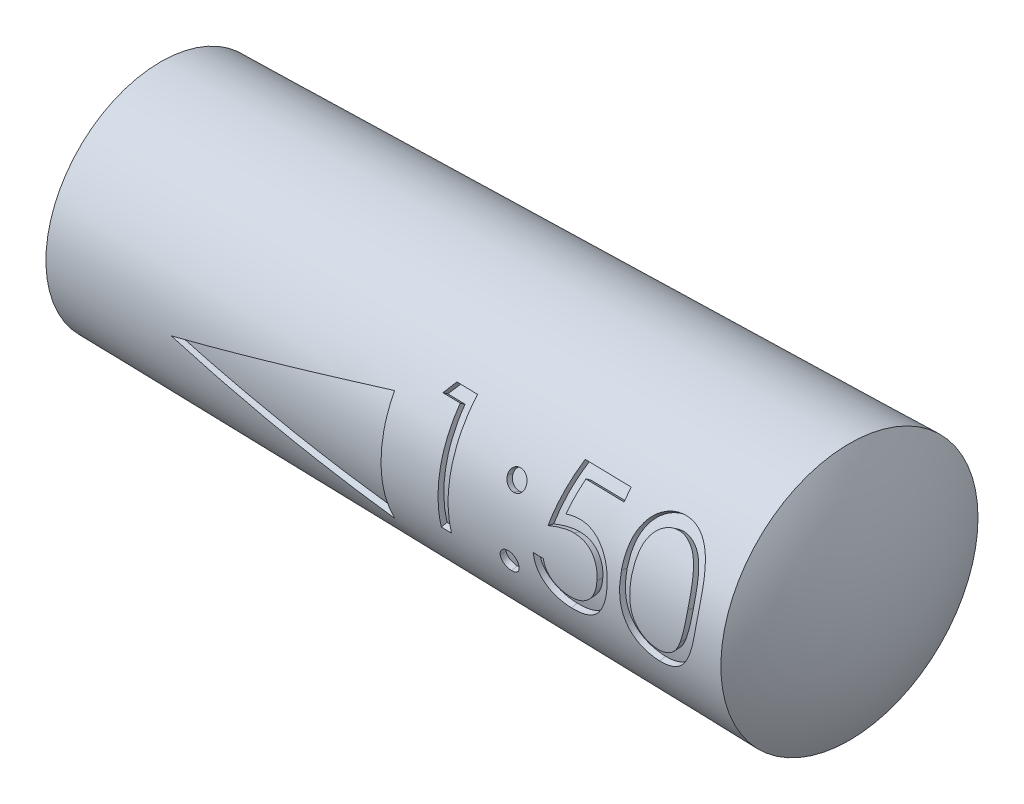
SolidWorks part; units mm, degrees
ref_plane "Front Plane" through (0, 0, 0) normal (0, 0, 1) x (1, 0, 0)
ref_plane "Top Plane" through (0, 0, 0) normal (0, 1, 0) x (1, 0, 0)
ref_plane "Right Plane" through (0, 0, 0) normal (1, 0, 0) x (0, 0, -1)
sketch "Sketch1" plane through (0, 0, 0) normal (1, 0, 0) x (0, 0, -1)
  circle A0 centre (0, 0) radius 1
  dimension "D1" = 2
extrude "Extrude1" add sketch "Sketch1" along normal mid plane 6
draft "Draft1" type of draft neutral plane draft angle 1.146 faces to draft 1 parameters "D1"=1.146
sketch "Sketch2" plane through (0, 0, 0) normal (0, 0, 1) x (1, 0, 0)
  line L0 (-3, 0) -> (-3, 1)
  line L1 (-3, 1) -> (-3, -1) construction
  line L2 (-3, 0) -> (-3.3, 0)
  line L3 (-3.3, 0) -> (-3.3, -1.06) construction
  line L4 (3, 0) -> (3, 1.12)
  line L5 (3, -1.12) -> (3, 1.12) construction
  line L6 (3, 0) -> (3.3, 0)
  line L7 (3.3, 0) -> (3.3, -1.06) construction
  line L8 (-3, -1) -> (3, -1.12) construction
  arc A0 (-3.3, 0) -> (-3, 1) centre (-1.4833, 0) cw
  arc A1 (3.3, 0) -> (3, 1.12) centre (1.0593, 0) ccw
  point P14 (0, -1.06)
revolve "Revolve1" add sketch "Sketch2" angle 360 about L2
sketch "Sketch5" plane through (0, 0, 0) normal (0, 0, 1) x (1, 0, 0)
  line L0 (0, 1.06) -> (0, -1.06) construction
  line L1 (3, 1.12) -> (-3, 1) construction
  line L2 (-3, -1) -> (3, -1.12) construction
ref_plane "Plane2" through (0, 0, 0) normal (-0.02, 0, 0.9998) x (0.9998, 0, 0.02)
sketch "Sketch6" plane through (0, 0, 0) normal (-0.02, 0, 0.9998) x (0.9998, 0, 0.02)
  line L0 (0, 0) -> (0, 0.5)
  line L1 (0, 1.06) -> (0, -1.06) construction
  line L2 (0, 0.5) -> (-1.866, 0)
  line L3 (-1.866, 0) -> (0, -0.5)
  line L4 (0, -0.5) -> (0, 0)
  line L5 (0, -0.25) -> (3, -0.25) construction
  text T0 "1:50" font "Century Gothic" height 1
  dimension "D1" = 1
  dimension "D2" = 30
  dimension "D3" = 3
wrap "Wrap2" sketch "Sketch6" wrap type deboss source sketch "Sketch6" thickness 0.05 parameters "D1"=0.05
equation "\"D2@Sketch2\" = \"D1@Sketch2\""
